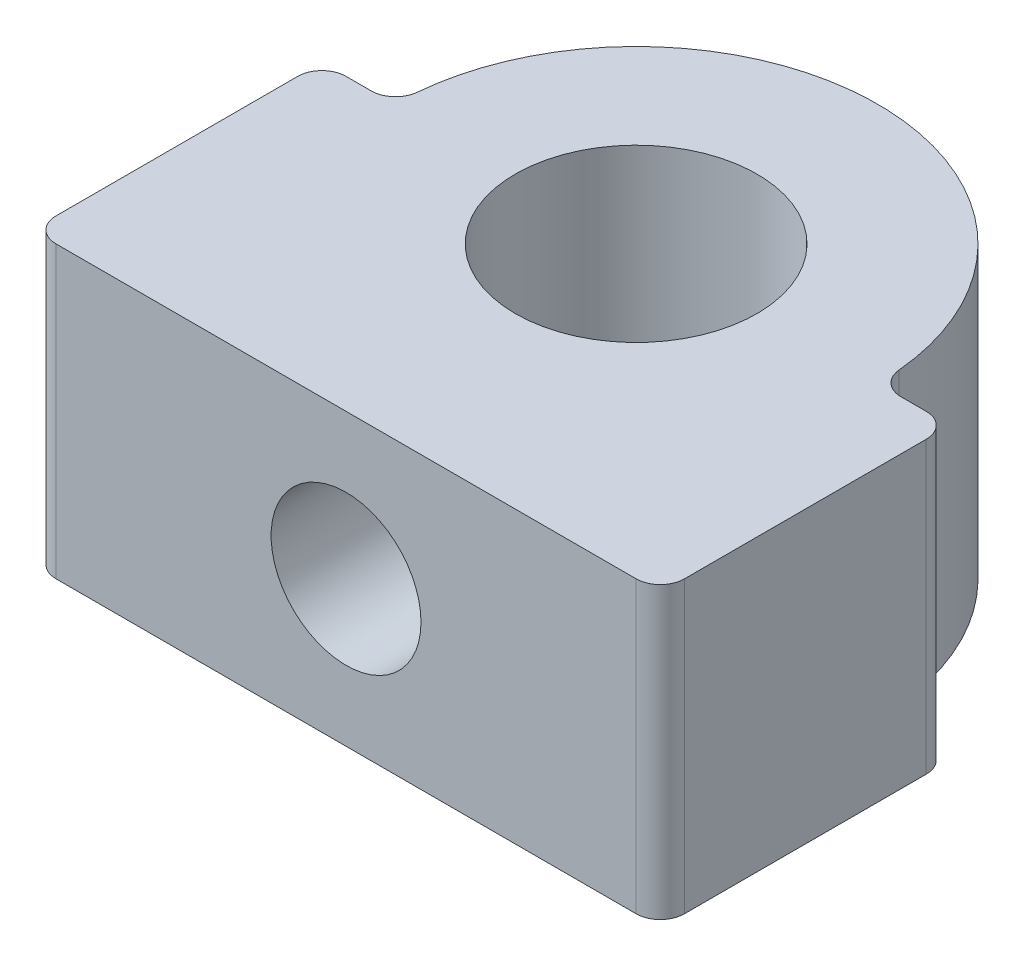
SolidWorks part; units mm, degrees
ref_plane "Piano frontale" through (0, 0, 0) normal (0, 0, 1) x (1, 0, 0)
ref_plane "Piano superiore" through (0, 0, 0) normal (0, 1, 0) x (1, 0, 0)
ref_plane "Piano destro" through (0, 0, 0) normal (1, 0, 0) x (0, 0, -1)
sketch "Schizzo1" plane through (0, 0, 0) normal (0, 1, 0) x (1, 0, 0)
  line L0 (-5, 0) -> (-5, -6) construction
  line L1 (-5, -6) -> (5, -6)
  line L2 (5, -6) -> (5, 0) construction
  line L3 (-5.4772, 0) -> (-6, 0)
  line L4 (-6.5, -0.5) -> (-6.5, -5.5)
  line L5 (-6, -6) -> (-5, -6)
  line L6 (5, -6) -> (6, -6)
  line L7 (6.5, -5.5) -> (6.5, -0.5)
  line L8 (6, 0) -> (5.4772, 0)
  circle A0 centre (0, 0) radius 2.5 construction
  arc A1 (4.9793, 0.4545) -> (-4.9793, 0.4545) centre (0, 0) ccw
  arc A2 (-6.5, -5.5) -> (-6, -6) centre (-6, -5.5) ccw
  arc A3 (6, -6) -> (6.5, -5.5) centre (6, -5.5) ccw
  arc A4 (-6, 0) -> (-6.5, -0.5) centre (-6, -0.5) ccw
  arc A5 (6.5, -0.5) -> (6, 0) centre (6, -0.5) ccw
  arc A6 (5.4772, 0) -> (4.9793, 0.4545) centre (5.4772, 0.5) cw
  arc A7 (-5.4772, 0) -> (-4.9793, 0.4545) centre (-5.4772, 0.5) ccw
  point P17 (-6.5, 0)
  point P20 (6.5, 0)
  dimension "D1" = 5
  dimension "D2" = 10
  dimension "D5" = 0.5
  dimension "D3" = 1.5
  dimension "D4" = 1.5
  dimension "D6" = 6
extrude "Estrusione-Estrusione1" add sketch "Schizzo1" along normal blind 6
sketch "Schizzo2" plane through (0, 0, 6) normal (0, 0, 1) x (1, 0, 0)
  line L0 (-6.5, 3) -> (-3.5, 3) construction
  line L3 (-3.5, 3) -> (3.5, 3) construction
  line L4 (3.5, 3) -> (6.5, 3) construction
  line L5 (6.5, 6) -> (6.5, 0) construction
  line L6 (-6.5, 6) -> (-6.5, 0) construction
  circle A0 centre (-3.5, 3) radius 1.55 construction
  circle A1 centre (3.5, 3) radius 1.55 construction
  circle A2 centre (0, 3) radius 1.55
  point P10 (0, 3)
  dimension "D1" = 3.1
  dimension "D3" = 3.1
  dimension "D2" = 7
extrude "Taglio-Estrusione1" cut sketch "Schizzo2" against normal blind 5
sketch "Schizzo3" plane through (0, 6, 0) normal (0, 1, 0) x (1, 0, 0)
  circle A0 centre (0, 0) radius 2.5
  dimension "D1" = 5
extrude "Taglio-Estrusione2" cut sketch "Schizzo3" against normal through all
